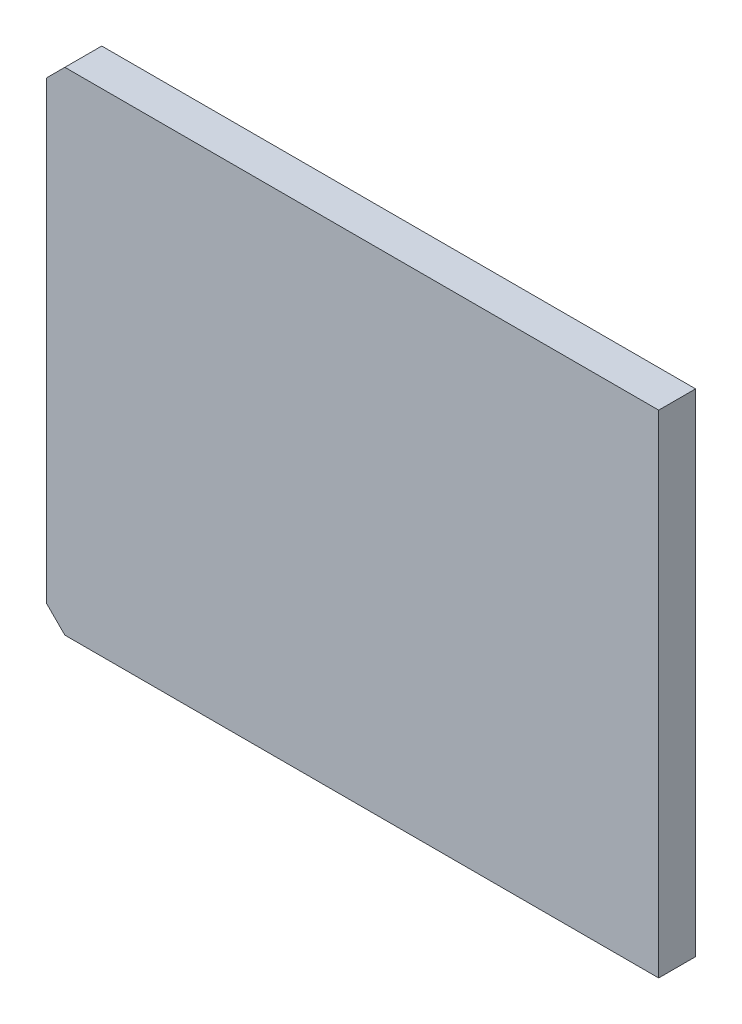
SolidWorks part; units mm, degrees
ref_plane "Front Plane" through (0, 0, 0) normal (0, 0, 1) x (1, 0, 0)
ref_plane "Top Plane" through (0, 0, 0) normal (0, 1, 0) x (1, 0, 0)
ref_plane "Right Plane" through (0, 0, 0) normal (1, 0, 0) x (0, 0, -1)
sketch "Sketch1" plane through (0, 0, 0) normal (0, 0, 1) x (1, 0, 0)
  line L1 (-24.9, 20) -> (24.9, 20)
  line L2 (-24.9, 20) -> (-24.9, -20)
  line L3 (-24.9, -20) -> (24.9, -20)
  line L4 (24.9, 20) -> (24.9, -20)
  line L5 (-24.9, 20) -> (24.9, -20) construction
  line L6 (-24.9, -20) -> (24.9, 20) construction
  point P0 (0, 0)
  dimension "D1" = 40
  dimension "D2" = 49.8
extrude "Boss-Extrude1" add sketch "Sketch1" along normal blind 3
chamfer "Chamfer1" distance 1.5 angle 45 2 edges at (-24.9, -20, 1.5) (-24.9, 20, 1.5)
